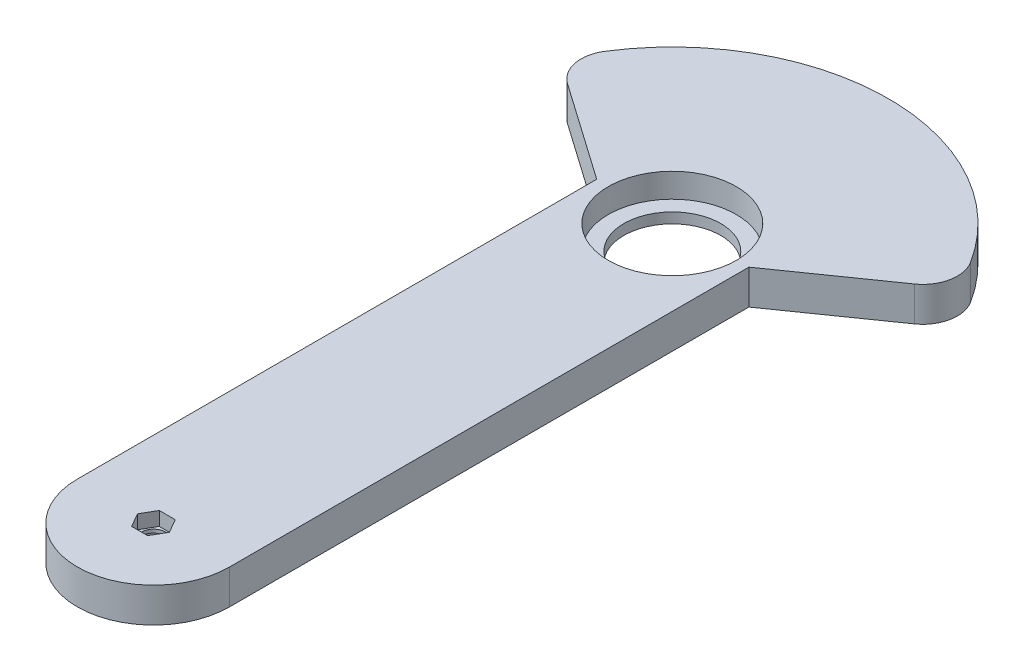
SolidWorks part; units mm, degrees
ref_plane "Front Plane" through (0, 0, 0) normal (0, 0, 1) x (1, 0, 0)
ref_plane "Top Plane" through (0, 0, 0) normal (0, 1, 0) x (1, 0, 0)
ref_plane "Right Plane" through (0, 0, 0) normal (1, 0, 0) x (0, 0, -1)
sketch "Sketch1" plane through (0, 0, 0) normal (0, 1, 0) x (1, 0, 0)
  line L0 (0, 0) -> (-39049.5542, 0) construction
  line L1 (0, 0) -> (0, -39049.5542) construction
  line L2 (-50.1264, 19.8392) -> (-7.1697, -10.2394)
  line L3 (50.1264, 19.8392) -> (7.1697, -10.2394)
  arc A0 (-7.1697, -10.2394) -> (7.1697, -10.2394) centre (0, 0) ccw
  arc A1 (52.846, 33.3699) -> (-52.846, 33.3699) centre (0, 0) ccw
  arc A2 (50.1264, 19.8392) -> (52.846, 33.3699) centre (44.3906, 28.0307) ccw
  arc A3 (-50.1264, 19.8392) -> (-52.846, 33.3699) centre (-44.3906, 28.0307) cw
  point P13 (57.3323, 24.8848)
  point P16 (-57.3323, 24.8848)
  dimension "D1" = 25
  dimension "D2" = 125
  dimension "D3" = 0
  dimension "D5" = 10
  dimension "D4" = 35
extrude "Boss-Extrude1" add sketch "Sketch1" along normal blind 10 contours L2 A0 L3 A2 A1 A3
sketch "Sketch2" plane through (0, 0, 0) normal (0, 1, 0) x (1, 0, 0)
  line L0 (0, 0) -> (-50000, 0) construction
  line L1 (0, 0) -> (0, -50000) construction
  line L2 (-22, 0.1449) -> (-22, -150)
  line L3 (-50.1264, 19.8392) -> (-7.1697, -10.2394) construction
  line L5 (22, 0.1449) -> (22, -150)
  line L6 (50.1264, 19.8392) -> (7.1697, -10.2394) construction
  line L7 (22, 0.1449) -> (7.1697, -10.2394)
  line L8 (-22, 0.1449) -> (-7.1697, -10.2394)
  arc A0 (-7.1697, -10.2394) -> (7.1697, -10.2394) centre (0, 0) ccw construction
  arc A1 (-7.1697, -10.2394) -> (7.1697, -10.2394) centre (0, 0) ccw
  arc A2 (-22, -150) -> (22, -150) centre (0, -150) ccw
  point P11 (0, -150)
  dimension "D2" = 22
  dimension "D3" = 150
  dimension "D1" = 22
extrude "Boss-Extrude2" add sketch "Sketch2" along normal blind 10
sketch "Sketch3" plane through (0, 10, 0) normal (0, 1, 0) x (1, 0, 0)
  line L0 (0, 0) -> (-50000, 0) construction
  line L1 (0, 0) -> (0, -50000) construction
  circle A0 centre (0, 0) radius 18.5
  dimension "D1" = 37
extrude "Cut-Extrude1" cut sketch "Sketch3" against normal blind 7
sketch "Sketch4" plane through (0, 10, 0) normal (0, 1, 0) x (1, 0, 0)
  line L0 (0, 0) -> (-50000, 0) construction
  line L1 (0, 0) -> (0, -50000) construction
  circle A0 centre (0, 0) radius 14
  dimension "D1" = 28
extrude "Cut-Extrude2" cut sketch "Sketch4" against normal through all
sketch "Sketch5" plane through (0, 10, 0) normal (0, 1, 0) x (1, 0, 0)
  line L0 (0, 0) -> (-50000, 0) construction
  line L1 (0, 0) -> (0, -50000) construction
  circle A0 centre (0, -150) radius 3.5
  arc A1 (-22, -150) -> (22, -150) centre (0, -150) ccw construction
  dimension "D2" = 7
extrude "Cut-Extrude3" cut sketch "Sketch5" against normal through all
sketch "Sketch6" plane through (0, 0, 0) normal (0, -1, 0) x (1, 0, 0)
  line L0 (0, 0) -> (0, 50000) construction
  circle A0 centre (0, 150) radius 8
  dimension "D1" = 16
extrude "Cut-Extrude4" cut sketch "Sketch6" against normal blind 5
sketch "Sketch7" plane through (0, 10, 0) normal (0, 1, 0) x (1, 0, 0)
  line L1 (4.6188, -150) -> (2.3094, -146)
  line L2 (2.3094, -146) -> (-2.3094, -146)
  line L3 (-2.3094, -146) -> (-4.6188, -150)
  line L4 (-4.6188, -150) -> (-2.3094, -154)
  line L5 (-2.3094, -154) -> (2.3094, -154)
  line L6 (2.3094, -154) -> (4.6188, -150)
  circle A0 centre (0, -150) radius 4 construction
  dimension "D1" = 8
extrude "Cut-Extrude5" cut sketch "Sketch7" against normal blind 4
